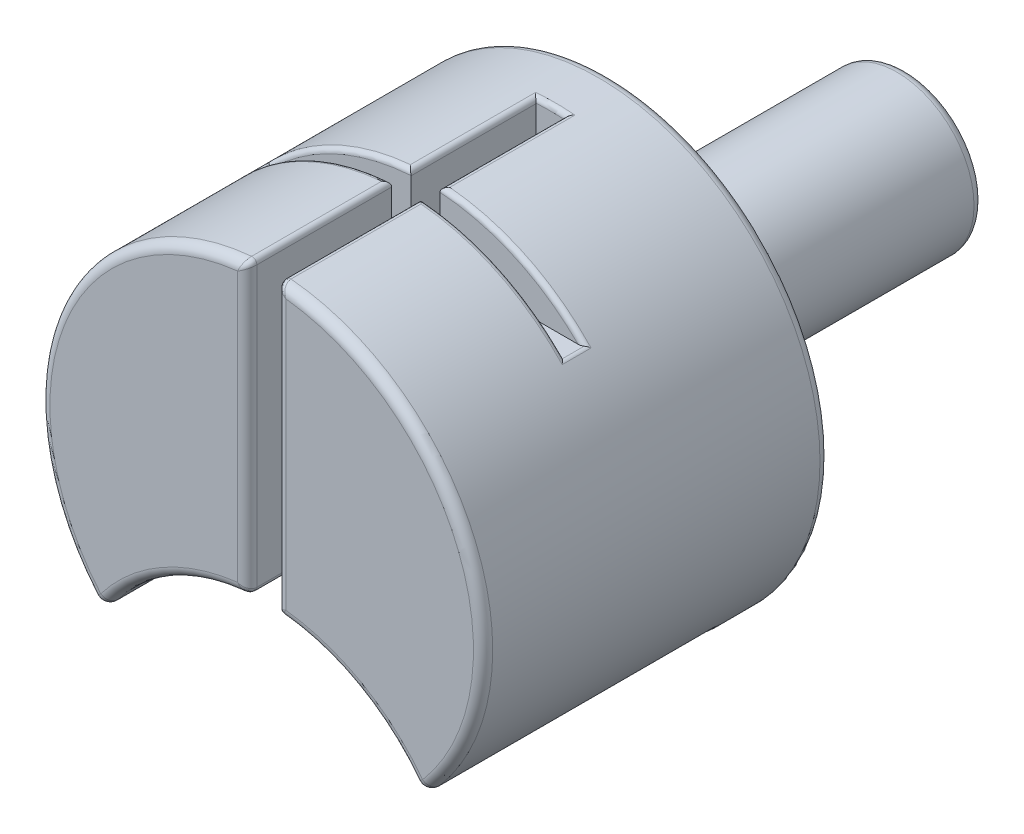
SolidWorks part; units mm, degrees
ref_plane "Спереди" through (0, 0, 0) normal (0, 0, 1) x (1, 0, 0)
ref_plane "Сверху" through (0, 0, 0) normal (0, 1, 0) x (1, 0, 0)
ref_plane "Справа" through (0, 0, 0) normal (1, 0, 0) x (0, 0, -1)
sketch "Эскиз1" plane through (0, 0, 0) normal (1, 0, 0) x (0, 0, -1)
  line L0 (-11.75, 0) -> (11.75, 0)
  line L1 (11.75, 0) -> (11.75, 1.75)
  line L2 (11.75, 1.75) -> (21.75, 1.75)
  line L3 (21.75, 1.75) -> (21.75, 4)
  line L4 (21.75, 4) -> (6.25, 4)
  line L5 (6.25, 4) -> (6.25, 11.5)
  line L6 (6.25, 11.5) -> (-11.75, 11.5)
  line L7 (-11.75, 11.5) -> (-11.75, 0)
  dimension "D1" = 11.5
  dimension "D2" = 18
  dimension "D3" = 10
  dimension "D4" = 15.5
  dimension "D5" = 4
  dimension "D6" = 1.75
revolve "Повернуть1" add sketch "Эскиз1" angle 360 about L0
sketch "Эскиз2" plane through (0, 0, 11.75) normal (0, 0, 1) x (1, 0, 0)
  line L0 (0, 0) -> (0, -11.5) construction
  line L1 (-10.9545, -3.5) -> (10.9545, -3.5) construction
  line L3 (0.75, 11.5) -> (-0.75, 11.5)
  line L4 (0.75, 11.5) -> (0.75, -3.5282)
  line L6 (-0.75, 11.5) -> (-0.75, -3.5282)
  line L7 (0.75, 11.5) -> (-1.0098, -15.4843) construction
  line L8 (1.0098, -15.4843) -> (-0.75, 11.5) construction
  arc A0 (-0.75, -3.5282) -> (0.75, -3.5282) centre (0, -13.5) ccw
  circle A1 centre (0, 0) radius 11.5 construction
  dimension "D1" = 20
  dimension "D2" = 8
  dimension "D3" = 1.5
  dimension "D4" = 0.75
extrude "Вырез-Вытянуть1" cut sketch "Эскиз2" against normal blind 15
sketch "Эскиз3" plane through (0, 0, 0) normal (1, 0, 0) x (0, 0, -1)
  line L0 (3.25, 11.4755) -> (-11.75, 11.4755) construction
  line L1 (-3.25, 14.9755) -> (-4.25, 14.9755)
  line L2 (-3.25, 14.9755) -> (-3.25, 7.9755)
  line L3 (-3.25, 7.9755) -> (-4.25, 7.9755)
  line L4 (-4.25, 14.9755) -> (-4.25, 7.9755)
  line L5 (-3.25, 14.9755) -> (-4.25, 7.9755) construction
  line L6 (-3.25, 7.9755) -> (-4.25, 14.9755) construction
  line L7 (-11.75, 11.4755) -> (-11.75, -7.9444) construction
  point P0 (-3.75, 11.4755)
  dimension "D1" = 1
  dimension "D2" = 3.5
  dimension "D3" = 8
extrude "Вырез-Вытянуть2" cut sketch "Эскиз3" against normal mid plane 25
fillet "Скругление1" radius 0.5 16 edges at (8.3148, -7.9444, 4.25) (-8.3148, -7.9444, 4.25) (-0.75, 3.9737, 11.75) (-5.0417, -4.8639, 11.75) (-10.7157, 4.1742, 11.75) (10.7157, 4.1742, 11.75) (5.0417, -4.8639, 11.75) (0.75, 3.9737, 11.75) (1.75, 0, -11.75) (1.75, 0, -21.75) (4, 0, -21.75) (4, 0, -6.25) (5.0417, -4.8639, -3.25) (-5.0417, -4.8639, -3.25) (0, -11.5, -3.25) (11.5, 0, -6.25)
fillet "Скругление2" radius 0.25 19 edges at (0.75, -3.7156, -3.1399) (0.8179, -3.4653, 11.5017) (-0.75, -3.6375, -3.0617) (-0.8179, -3.4653, 11.5017) (0.8113, 11.4099, 11.4899) (-0.8113, 11.4099, 11.4899) (0.75, -3.5282, 4.25) (-0.75, -3.5282, 4.25) (0.75, 11.4755, 7.75) (-0.75, 11.4755, 7.75) (4.8446, 10.4298, 4.25) (-8.285, 7.9755, 3.75) (8.285, 7.9755, 3.75) (4.8446, 10.4298, 3.25) (0.75, 11.4755, 0) (0, 11.5, -3.25) (-0.75, 11.4755, 0) (-4.8446, 10.4298, 4.25) (-4.8446, 10.4298, 3.25)
